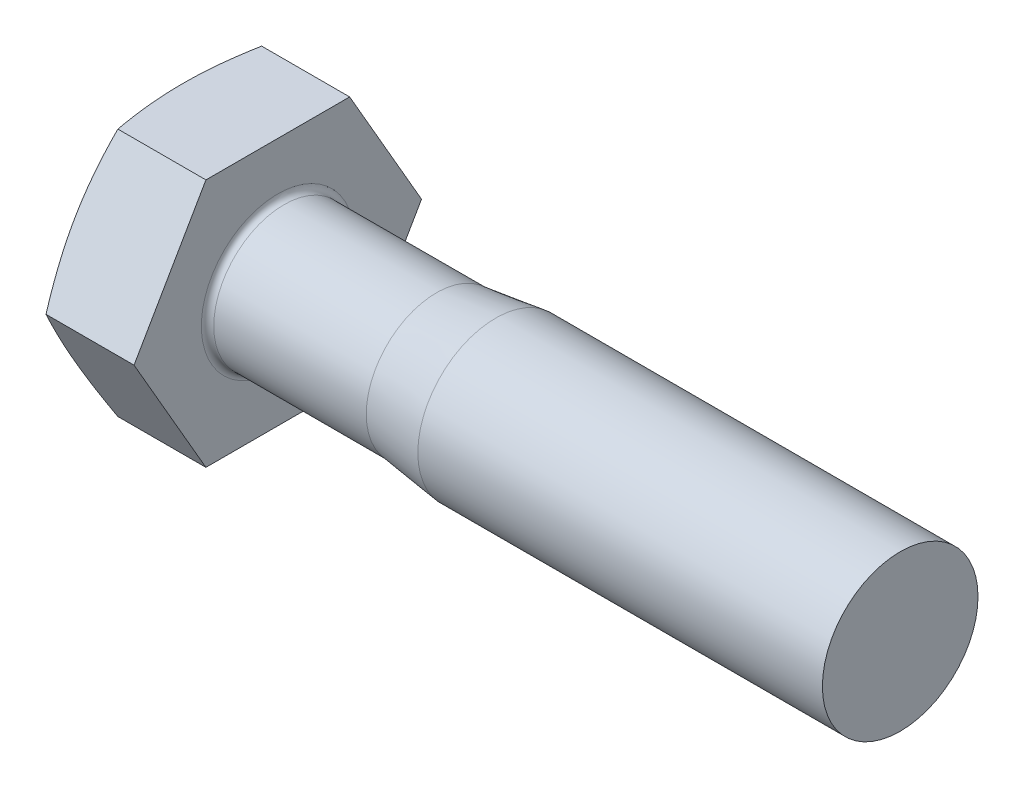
SolidWorks part; units mm, degrees
ref_plane "Front" through (0, 0, 0) normal (0, 0, 1) x (1, 0, 0)
ref_plane "Top" through (0, 0, 0) normal (0, 1, 0) x (1, 0, 0)
ref_plane "Right" through (0, 0, 0) normal (1, 0, 0) x (0, 0, -1)
sketch "Sketch1" plane through (0, 0, 0) normal (1, 0, 0) x (0, 0, -1)
  line L1 (9.2376, 0) -> (4.6188, 8)
  line L2 (4.6188, 8) -> (-4.6188, 8)
  line L3 (-4.6188, 8) -> (-9.2376, 0)
  line L4 (-9.2376, 0) -> (-4.6188, -8)
  line L5 (-4.6188, -8) -> (4.6188, -8)
  line L6 (4.6188, -8) -> (9.2376, 0)
  circle A0 centre (0, 0) radius 8 construction
  dimension "s" = 16
extrude "BaseHead" add sketch "Sketch1" along normal blind 6.4
ref_plane "Plane1" through (20.4, 0, 0) normal (1, 0, 0) x (0, 0, -1)
sketch "Sketch2" plane through (6.4, 0, 0) normal (1, 0, 0) x (0, 0, -1)
  circle A0 centre (0, 0) radius 5
  dimension "d" = 10
extrude "BaseBody" add sketch "Sketch2" along normal blind 40
sketch "Sketch3" plane through (3.1612, 0, 2.6123) normal (0, 1, 0) x (0, 0, -1)
  line L0 (2.6123, 5.2326) -> (2.6123, 1.6388) construction
  line L2 (11.8499, 3.1612) -> (11.8499, 2.4196)
  line L3 (11.8499, 2.4196) -> (9.8123, 3.1612)
  line L5 (9.8123, 3.1612) -> (11.8499, 3.1612)
  dimension "D1" = 20
  dimension "dw" = 14.4
revolve "HeadChamfer" cut sketch "Sketch3" angle 360 about L0
sketch "Sketch4" plane through (0, 0, 0) normal (-1, 0, 0) x (0, 0, 1)
  circle A0 centre (0, 0) radius 5.6
  dimension "da" = 11.2
extrude "Cut-Extrude1" cut sketch "Sketch4" against normal blind 1.28
sketch "Sketch5" plane through (-2.6796, 0, 8.1796) normal (0, 1, 0) x (0, 0, -1)
  line L0 (8.1796, 0.0175) -> (8.1796, -16.2361) construction
  line L2 (13.1796, -23.0796) -> (12.6926, -19.2796)
  line L4 (12.6926, -19.2796) -> (12.6926, -9.0796)
  line L6 (12.6926, -9.0796) -> (17.2056, -9.0796)
  line L7 (17.2056, -9.0796) -> (17.2056, -23.0796)
  line L8 (17.2056, -23.0796) -> (13.1796, -23.0796)
  line L11 (8.1796, -49.0796) -> (8.1796, -9.0796) construction
  line L14 (12.7984, -9.0796) -> (3.5608, -9.0796) construction
  line L16 (3.1796, -49.0796) -> (13.1796, -49.0796) construction
  line L17 (13.1796, -49.0796) -> (13.1796, -9.0796) construction
  dimension "ds" = 9.026
  dimension "x" = 3.8
  dimension "D3" = 26
  dimension "D4" = 18.052
revolve "Cut-Revolve1" cut sketch "Sketch5" angle 360 about L0
fillet "HeadFillet" radius 0.4 1 edges at (6.4, 0, 4.513)
equation "\"D1@Cut-Extrude1\" = 0.2 * \"k@BaseHead\""
equation "\"b@ThreadCosmetic1\" = \"l@BaseBody\" - \"lg@Plane1\""
equation "\"D4@Sketch5\" = 2 * \"ds@Sketch5\""
equation "\"D3@Sketch5\" = \"l@BaseBody\" - \"lg@Plane1\""
